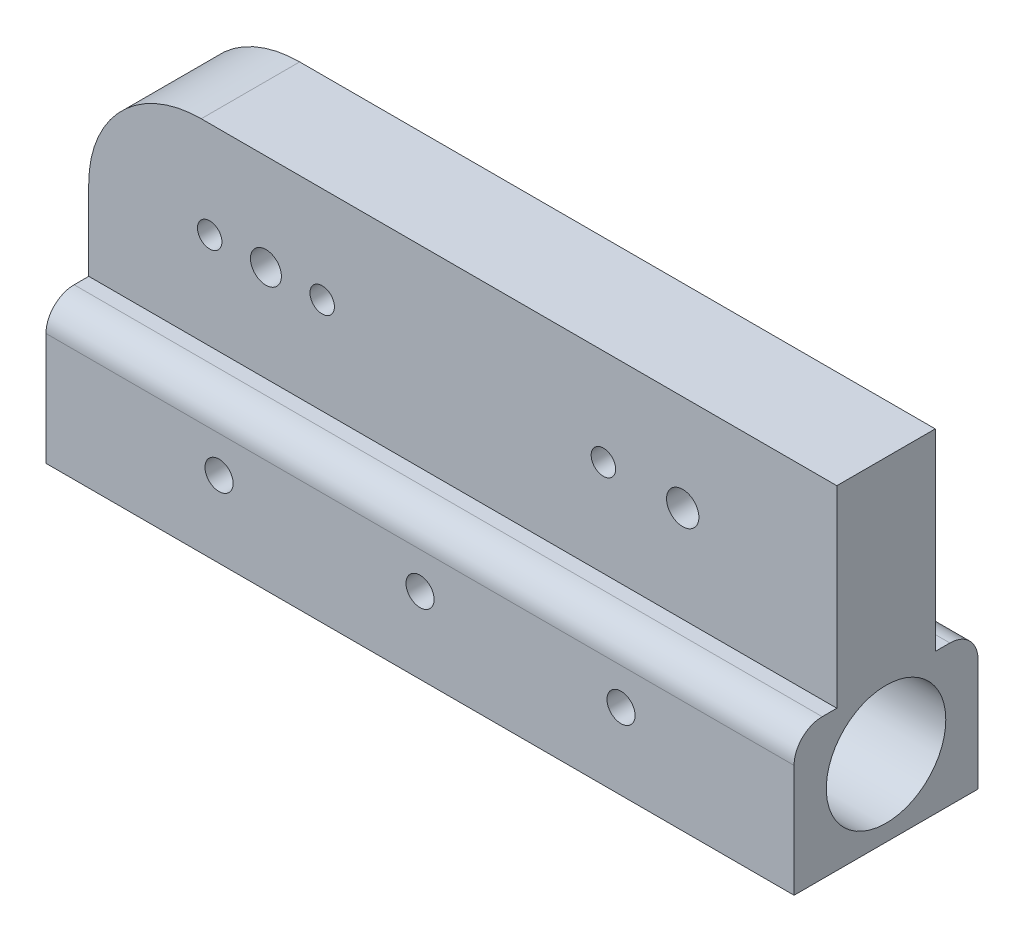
SolidWorks part; units mm, degrees
ref_plane "Front Plane" through (0, 0, 0) normal (0, 0, 1) x (1, 0, 0)
ref_plane "Top Plane" through (0, 0, 0) normal (0, 1, 0) x (1, 0, 0)
ref_plane "Right Plane" through (0, 0, 0) normal (1, 0, 0) x (0, 0, -1)
sketch "Sketch1" plane through (0, 0, 0) normal (0, 0, 1) x (1, 0, 0)
  line L1 (-9.1294, 55.727) -> (44.0719, 55.727)
  line L2 (-9.1294, 55.727) -> (-9.1294, 61.4334)
  line L3 (-1.1294, 69.4334) -> (44.0719, 69.4334)
  line L4 (44.0719, 55.727) -> (44.0719, 69.4334)
  line L5 (-9.1294, 55.727) -> (44.0719, 69.4334) construction
  line L6 (-9.1294, 69.4334) -> (44.0719, 55.727) construction
  circle A0 centre (-0.5288, 62.5802) radius 0.87
  circle A1 centre (3.4712, 62.5802) radius 1.1
  circle A2 centre (7.4712, 62.5802) radius 0.87
  circle A3 centre (27.4712, 62.5802) radius 0.87
  circle A4 centre (33.1112, 62.5802) radius 1.15
  arc A5 (-1.1294, 69.4334) -> (-9.1294, 61.4334) centre (-1.1294, 61.4334) ccw
  point P10 (17.4712, 62.5802)
  dimension "D1" = 8
extrude "Boss-Extrude1" add sketch "Sketch1" along normal blind 7
sketch "Sketch2" plane through (-9.1294, 0, 0) normal (-1, 0, 0) x (0, 0, 1)
  line L0 (-1.04, 55.727) -> (8.04, 55.727)
  line L3 (-3.04, 53.727) -> (-3.04, 45.727)
  line L4 (-3.04, 45.727) -> (10.04, 45.727)
  line L5 (3.5, 55.1436) -> (3.5, 47.1436) construction
  line L6 (7, 55.727) -> (0, 55.727) construction
  line L7 (10.04, 53.727) -> (10.04, 45.727)
  circle A0 centre (3.5, 51.1436) radius 4
  arc A1 (10.04, 53.727) -> (8.04, 55.727) centre (8.04, 53.727) ccw
  arc A2 (-1.04, 55.727) -> (-3.04, 53.727) centre (-1.04, 53.727) ccw
  point P7 (3.5, 45.727)
  point P12 (3.5, 55.727)
  point P14 (10.04, 55.727)
  point P17 (-3.04, 55.727)
  dimension "D1" = 2
extrude "Boss-Extrude2" add sketch "Sketch2" against normal up to surface (53.2013 mm away)
sketch "Sketch3" plane through (0, 0, 10.04) normal (0, 0, 1) x (1, 0, 0)
  line L0 (3.1778, 51.1436) -> (17.4712, 51.1436) construction
  line L3 (17.4712, 51.1436) -> (17.4712, 46.0336) construction
  circle A0 centre (3.1778, 51.1436) radius 1
  circle A1 centre (17.4712, 51.1436) radius 1
  circle A2 centre (31.7647, 51.1436) radius 1
extrude "Cut-Extrude2" cut sketch "Sketch3" against normal blind 6
sketch "Sketch4" plane through (44.0719, 0, 0) normal (1, 0, 0) x (0, 0, -1)
  circle A0 centre (-3.5, 51.1436) radius 4.25
extrude "Cut-Extrude3" cut sketch "Sketch4" against normal blind 73
